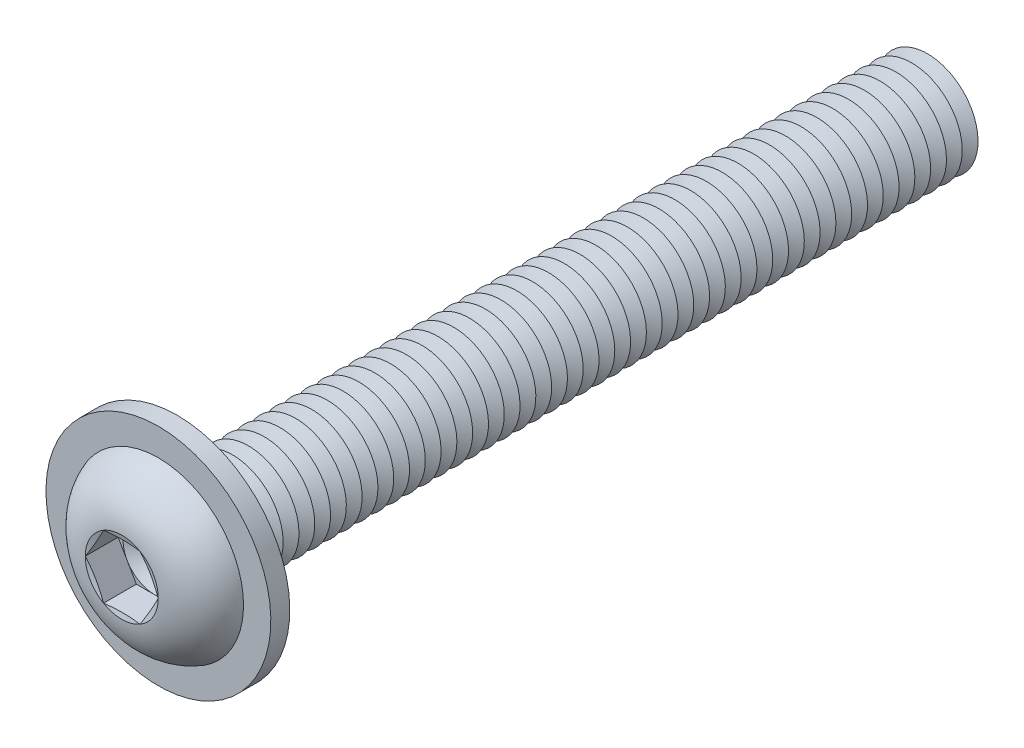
SolidWorks part; units mm, degrees
ref_plane "Front Plane" through (0, 0, 0) normal (0, 0, 1) x (1, 0, 0)
ref_plane "Top Plane" through (0, 0, 0) normal (0, 1, 0) x (1, 0, 0)
ref_plane "Right Plane" through (0, 0, 0) normal (1, 0, 0) x (0, 0, -1)
sketch "Sketch1" plane through (0, 0, 0) normal (1, 0, 0) x (0, 0, -1)
  line L0 (0, 4) -> (0, 7)
  line L3 (0, 4) -> (60, 4)
  line L4 (60, 4) -> (60, 0)
  line L5 (60, 0) -> (-4.4, 0) construction
  line L6 (-4.4, 0) -> (60, 0)
  line L7 (-4.4, 2.8867) -> (-4.4, 1.4434) construction
  line L8 (-4.4, 1.4434) -> (-4.4, 0)
  line L9 (-4.4, 2.8867) -> (-4.0132, 1.4434)
  line L10 (-4.0132, 1.4434) -> (-4.4, 1.4434)
  line L11 (60, 0) -> (22.7481, 0) construction
  line L12 (0, 7) -> (-4.4, 7) construction
  arc A1 (0, 7) -> (-4.4, 2.8867) centre (0, 2.59) ccw
  point P8 (60, 2)
  dimension "D1" = 14
  dimension "D2" = 8
  dimension "D3" = 4.4
  dimension "D4" = 5.7735
  dimension "D5" = 60
  dimension "D6" = 15
revolve "Revolve1" add sketch "Sketch1" angle 360 about L5
fillet "Fillet1" radius 0.625 1 edges at (0, 4, 0)
sketch "Sketch2" plane through (0, 0, 0) normal (1, 0, 0) x (0, 0, -1)
  line L0 (59.375, 4) -> (60.625, 4)
  line L1 (60, 4) -> (0.625, 4) construction
  line L2 (60.625, 4) -> (60, 2.9175)
  line L3 (60, -4) -> (60, 4) construction
  line L4 (60, 2.9175) -> (59.375, 4)
  dimension "D1" = 1.25
revolve "Cut-Revolve1" cut sketch "Sketch2" angle 360 about axis through (0, 0, -60) along (0, 0, -1)
pattern_linear "LPattern1" count 48 spacing 1.25 along (0, 0, 1) of "Cut-Revolve1"
sketch "Sketch3" plane through (0, 0, 4.4) normal (0, 0, 1) x (1, 0, 0)
  line L7 (1.4434, 2.5) -> (-1.4434, 2.5)
  line L8 (-1.4434, 2.5) -> (-2.8867, 0)
  line L9 (-2.8867, 0) -> (-1.4434, -2.5)
  line L10 (-1.4434, -2.5) -> (1.4434, -2.5)
  line L11 (1.4434, -2.5) -> (2.8867, 0)
  line L12 (2.8867, 0) -> (1.4434, 2.5)
  circle A0 centre (0, 0) radius 2.5 construction
  circle A3 centre (0, 0) radius 2.8867 construction
extrude "Cut-Extrude1" cut sketch "Sketch3" against normal blind 2.6
sketch "Sketch4" plane through (0, 0, 1.8) normal (0, 0, 1) x (1, 0, 0)
  line L1 (1.4434, 2.5) -> (-1.4434, 2.5) construction
  circle A0 centre (0, 0) radius 2.5
extrude "Cut-Extrude2" cut sketch "Sketch4" against normal through all draft 60
sketch "Sketch5" plane through (0, 0, 0) normal (0, 0, -1) x (-1, 0, 0)
  circle A0 centre (0, 0) radius 8.9
  circle A1 centre (0, 0) radius 4.625
  circle A2 centre (0, 0) radius 4.625 construction
  dimension "D1" = 17.8
extrude "Boss-Extrude1" add sketch "Sketch5" against normal blind 1.5
